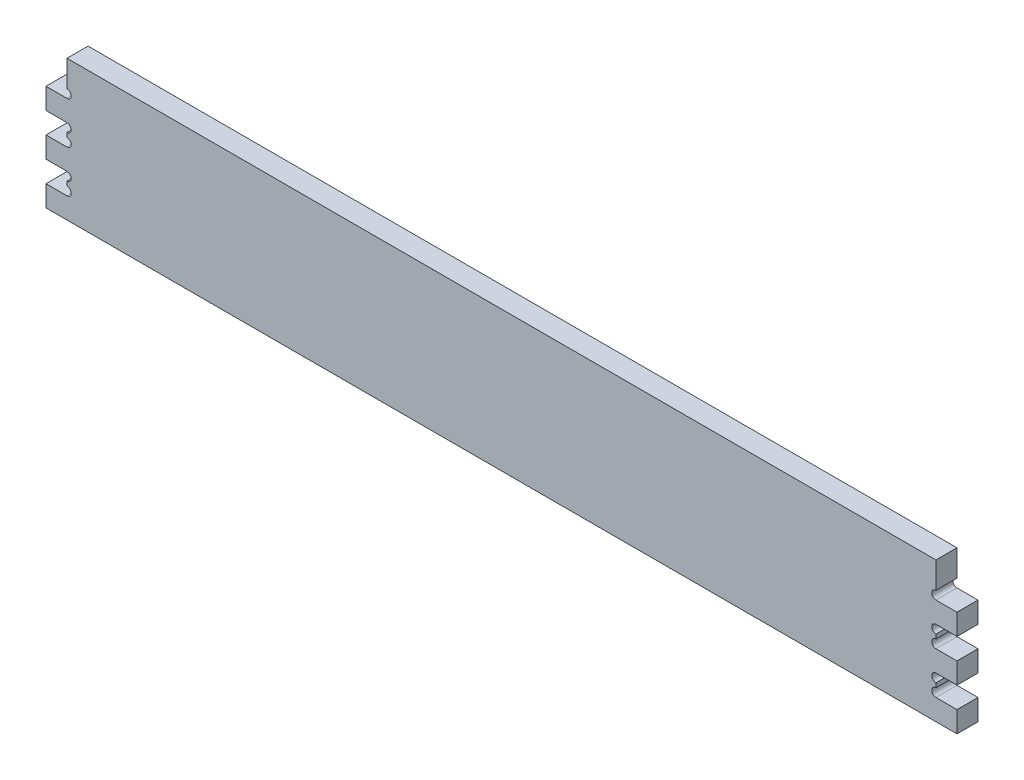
SolidWorks part; units mm, degrees
ref_plane "Ebene vorne" through (0, 0, 0) normal (0, 0, 1) x (1, 0, 0)
ref_plane "Ebene oben" through (0, 0, 0) normal (0, 1, 0) x (1, 0, 0)
ref_plane "Ebene rechts" through (0, 0, 0) normal (1, 0, 0) x (0, 0, -1)
sketch "Skizze1" plane through (0, 0, 0) normal (0, 0, 1) x (1, 0, 0)
  line L0 (0, 0) -> (620, 0)
  line L1 (0, 0) -> (-15, 0)
  line L2 (-15, 0) -> (-15, 15)
  line L3 (-15, 15) -> (0, 15)
  line L4 (620, 0) -> (635, 0)
  line L5 (0, 30.1) -> (-15, 30.1)
  line L6 (-15, 30.1) -> (-15, 45.1)
  line L7 (-15, 45.1) -> (0, 45.1)
  line L8 (0, 54.2) -> (0, 51.1)
  line L9 (0, 60.2) -> (-15, 60.2)
  line L10 (-15, 60.2) -> (-15, 75.2)
  line L11 (-15, 75.2) -> (0, 75.2)
  line L12 (0, 24.1) -> (0, 21)
  line L13 (0, 100) -> (620, 100)
  line L14 (0, 100) -> (0, 81.2)
  line L15 (635, 0) -> (635, 15)
  line L16 (635, 15) -> (620, 15)
  line L17 (620, 24.1) -> (620, 21)
  line L18 (620, 30.1) -> (635, 30.1)
  line L19 (635, 30.1) -> (635, 45.1)
  line L20 (635, 45.1) -> (620, 45.1)
  line L21 (620, 54.2) -> (620, 51.1)
  line L22 (620, 60.2) -> (635, 60.2)
  line L23 (635, 60.2) -> (635, 75.2)
  line L24 (635, 75.2) -> (620, 75.2)
  line L25 (620, 100) -> (620, 81.2)
  arc A0 (0, 15) -> (0, 21) centre (0, 18) ccw
  arc A1 (0, 24.1) -> (0, 30.1) centre (0, 27.1) ccw
  arc A2 (0, 45.1) -> (0, 51.1) centre (0, 48.1) ccw
  arc A3 (0, 54.2) -> (0, 60.2) centre (0, 57.2) ccw
  arc A4 (0, 75.2) -> (0, 81.2) centre (0, 78.2) ccw
  arc A5 (620, 81.2) -> (620, 75.2) centre (620, 78.2) ccw
  arc A6 (620, 60.2) -> (620, 54.2) centre (620, 57.2) ccw
  arc A7 (620, 51.1) -> (620, 45.1) centre (620, 48.1) ccw
  arc A8 (620, 30.1) -> (620, 24.1) centre (620, 27.1) ccw
  arc A9 (620, 21) -> (620, 15) centre (620, 18) ccw
  dimension "D1" = 6
  dimension "D2" = 15
  dimension "D3" = 15.1
  dimension "D4" = 15
  dimension "D5" = 15.1
  dimension "D6" = 15
  dimension "D7" = 620
  dimension "D8" = 6
  dimension "D9" = 6
  dimension "D10" = 6
  dimension "D11" = 6
  dimension "D12" = 15.1
  dimension "D13" = 15
  dimension "D14" = 15.1
  dimension "D15" = 15
  dimension "D16" = 15
  dimension "D17" = 6
  dimension "D18" = 6
  dimension "D19" = 6
  dimension "D20" = 6
  dimension "D21" = 6
  dimension "D22" = 15
  dimension "D23" = 15
  dimension "D24" = 15
  dimension "D25" = 15
  dimension "D26" = 15
  dimension "D27" = 620
  dimension "D28" = 100
extrude "Aufsatz-Linear austragen1" add sketch "Skizze1" along normal blind 15
